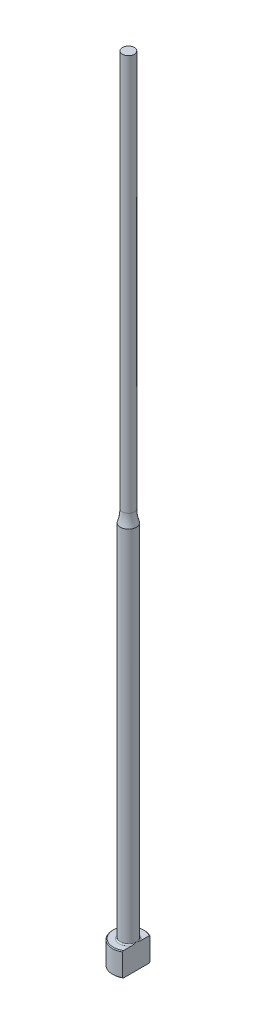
SolidWorks part; units mm, degrees
ref_plane "Front Plane" through (0, 0, 0) normal (0, 0, 1) x (1, 0, 0)
ref_plane "Top Plane" through (0, 0, 0) normal (0, 1, 0) x (1, 0, 0)
ref_plane "Right Plane" through (0, 0, 0) normal (1, 0, 0) x (0, 0, -1)
sketch "Sketch1" plane through (0, 0, 0) normal (0, 0, 1) x (1, 0, 0)
  line L0 (0, 259.9588) -> (0, -15.1925) construction
  line L1 (0, 0) -> (-4, 0)
  line L2 (-4, 0) -> (-4, 6)
  line L3 (-4, 6) -> (-2, 6)
  line L4 (-1.5, 100) -> (-1.5, 200)
  line L5 (-1.5, 200) -> (0, 200)
  line L6 (0, 200) -> (0, 0)
  line L7 (-2, 6) -> (-2, 96.8775)
  arc A0 (-2, 96.8775) -> (-1.5, 100) centre (-11.5, 100) ccw
  point P13 (-2, 0)
  dimension "D1" = 10
  dimension "L" = 200
  dimension "H" = 8
  dimension "T" = 6
  dimension "D" = 3
  dimension "B" = 4
  dimension "S" = 100
revolve "Revolve1" add sketch "Sketch1" angle 360 about L0
chamfer "Chamfer1" distance 0.2 angle 45 2 edges at (0, 6, 4) (0, 0, 4)
fillet "Fillet1" radius 0.3 1 edges at (0, 6, 2)
sketch "Sketch2" plane through (0, 0, 0) normal (0, 1, 0) x (1, 0, 0)
  line L0 (2, -3.4641) -> (2, 3.4641)
  circle A0 centre (0, 0) radius 4 construction
  arc A1 (2, -3.4641) -> (2, 3.4641) centre (0, 0) ccw
  circle A2 centre (0, 0) radius 2 construction
extrude "Keyed Head" cut sketch "Sketch2" along normal through all
